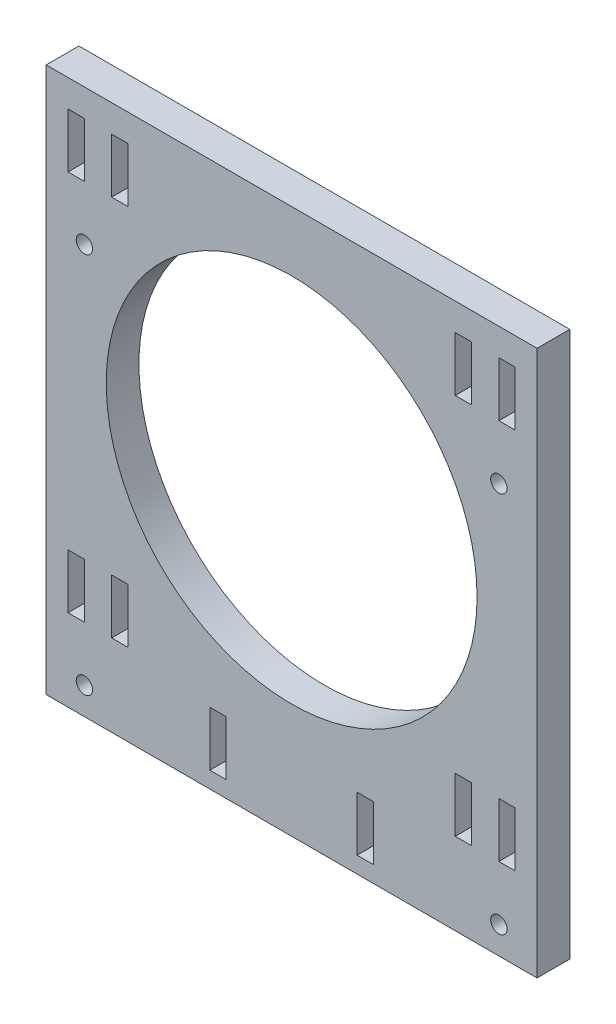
SolidWorks part; units mm, degrees
ref_plane "前视基准面" through (0, 0, 0) normal (0, 0, 1) x (1, 0, 0)
ref_plane "上视基准面" through (0, 0, 0) normal (0, 1, 0) x (1, 0, 0)
ref_plane "右视基准面" through (0, 0, 0) normal (1, 0, 0) x (0, 0, -1)
sketch "草图1" plane through (0, 0, 0) normal (0, 0, 1) x (1, 0, 0)
  line L0 (0, 0) -> (-23.7764, 7.7254) construction
  circle A0 centre (0, 0) radius 12.5
  circle A1 centre (0, 25) radius 12.5
  circle A2 centre (23.7764, 7.7254) radius 12.5
  circle A3 centre (14.6946, -20.2254) radius 12.5
  circle A4 centre (-14.6946, -20.2254) radius 12.5
  circle A5 centre (-23.7764, 7.7254) radius 12.5
  circle A6 centre (-23.7764, 7.7254) radius 10.5
  circle A7 centre (0, 25) radius 10.5
  circle A8 centre (23.7764, 7.7254) radius 10.5
  circle A9 centre (-14.6946, -20.2254) radius 10.5
  circle A10 centre (14.6946, -20.2254) radius 10.5
  circle A11 centre (-23.7764, 7.7254) radius 9
  circle A12 centre (0, 25) radius 9
  circle A13 centre (23.7764, 7.7254) radius 9
  circle A14 centre (14.6946, -20.2254) radius 9
  circle A15 centre (-14.6946, -20.2254) radius 9
  circle A17 centre (0, 0) radius 35.5
  point P16 (0, 0)
  dimension "D1" = 25
  dimension "D2" = 25
  dimension "D4" = 21
  dimension "D5" = 21
  dimension "D6" = 21
  dimension "D7" = 21
  dimension "D8" = 18
  dimension "D11" = 21
  dimension "D3" = 5
  dimension "D10" = 25
  dimension "D9" = 5
sketch "草图2" plane through (0, 0, 0) normal (0, 0, 1) x (1, 0, 0)
  line L0 (-10.5, 25) -> (-10.5, 27.9643)
  line L1 (10.5, 25) -> (10.5, 27.9643)
  line L2 (20.5317, 17.7115) -> (23.3509, 18.6275)
  line L3 (27.0211, -2.2607) -> (29.8403, -1.3447)
  line L4 (23.1893, -14.0537) -> (24.9317, -16.4518)
  line L5 (6.2, -26.3972) -> (7.9423, -28.7953)
  line L6 (-6.2, -26.3972) -> (-7.9423, -28.7953)
  line L7 (-23.1893, -14.0537) -> (-24.9317, -16.4518)
  line L8 (-27.0211, -2.2607) -> (-29.8403, -1.3447)
  line L9 (-20.5317, 17.7115) -> (-23.3509, 18.6275)
  line L11 (0, 0) -> (27.0211, -2.2607) construction
  circle A0 centre (14.6946, -20.2254) radius 10.5 construction
  circle A1 centre (-14.6946, -20.2254) radius 10.5 construction
  circle A2 centre (23.7764, 7.7254) radius 10.5 construction
  circle A3 centre (0, 25) radius 10.5 construction
  circle A4 centre (-23.7764, 7.7254) radius 10.5 construction
  circle A5 centre (0, 0) radius 35.5 construction
  arc A6 (23.1893, -14.0537) -> (6.2, -26.3972) centre (14.6946, -20.2254) ccw
  arc A7 (-6.2, -26.3972) -> (-23.1893, -14.0537) centre (-14.6946, -20.2254) ccw
  arc A8 (20.5317, 17.7115) -> (27.0211, -2.2607) centre (23.7764, 7.7254) ccw
  arc A9 (-10.5, 25) -> (10.5, 25) centre (0, 25) ccw
  arc A10 (-27.0211, -2.2607) -> (-20.5317, 17.7115) centre (-23.7764, 7.7254) ccw
  arc A11 (-16.3413, 31.5153) -> (-24.9231, 25.2802) centre (0, 0) ccw
  arc A12 (-35.0225, -5.8027) -> (-31.7446, -15.8912) centre (0, 0) ccw
  arc A13 (24.9231, 25.2802) -> (16.3413, 31.5153) centre (0, 0) ccw
  arc A14 (31.7446, -15.8912) -> (35.0225, -5.8027) centre (0, 0) ccw
  arc A15 (-5.3039, -35.1016) -> (5.3039, -35.1016) centre (0, 0) ccw
  arc A16 (23.3509, 18.6275) -> (24.9231, 25.2802) centre (22.1148, 22.4318) ccw
  arc A17 (10.5, 27.9643) -> (16.3413, 31.5153) centre (14.5, 27.9643) cw
  arc A18 (-10.5, 27.9643) -> (-16.3413, 31.5153) centre (-14.5, 27.9643) ccw
  arc A19 (-23.3509, 18.6275) -> (-24.9231, 25.2802) centre (-22.1148, 22.4318) cw
  arc A20 (24.9317, -16.4518) -> (31.7446, -15.8912) centre (28.1677, -14.1007) ccw
  arc A21 (7.9423, -28.7953) -> (5.3039, -35.1016) centre (4.7062, -31.1465) cw
  arc A22 (-7.9423, -28.7953) -> (-5.3039, -35.1016) centre (-4.7062, -31.1465) ccw
  arc A23 (-24.9317, -16.4518) -> (-31.7446, -15.8912) centre (-28.1677, -14.1007) cw
  arc A24 (-35.0225, -5.8027) -> (-29.8403, -1.3447) centre (-31.0763, -5.1489) cw
  arc A25 (29.8403, -1.3447) -> (35.0225, -5.8027) centre (31.0763, -5.1489) cw
  dimension "D2" = 4
  dimension "D3" = 4
  dimension "D1" = 5
sketch "草图3" plane through (0, 0, 0) normal (0, 0, 1) x (1, 0, 0)
  line L0 (-45, 45) -> (45, 45)
  line L1 (45, 45) -> (45, -45)
  line L3 (-45, -45) -> (-45, 45)
  line L4 (-45, -45) -> (-45, -55)
  line L7 (-45, -55) -> (45, -55)
  line L8 (45, -45) -> (45, -55)
  circle A16 centre (0, 0) radius 34
  dimension "D4" = 68
  dimension "D1" = 90
  dimension "D2" = 90
  dimension "D3" = 10
extrude "凸台-拉伸2" add sketch "草图3" along normal blind 6
sketch "草图4" plane through (0, 0, 6) normal (0, 0, 1) x (1, 0, 0)
  circle A0 centre (0, 0) radius 13.5
sketch "草图5" plane through (0, 0, 6) normal (0, 0, 1) x (1, 0, 0)
  line L0 (-33, 40) -> (-33, 30)
  line L1 (-33, 30) -> (-30, 30)
  line L2 (-30, 30) -> (-30, 40)
  line L3 (-30, 40) -> (-33, 40)
  line L4 (30, 40) -> (30, 30)
  line L5 (30, 30) -> (33, 30)
  line L6 (33, 30) -> (33, 40)
  line L7 (33, 40) -> (30, 40)
  line L8 (-33, -30) -> (-33, -40)
  line L9 (-33, -40) -> (-30, -40)
  line L10 (-30, -40) -> (-30, -30)
  line L11 (-30, -30) -> (-33, -30)
  line L12 (30, -30) -> (30, -40)
  line L13 (30, -40) -> (33, -40)
  line L14 (33, -40) -> (33, -30)
  line L15 (33, -30) -> (30, -30)
  line L16 (0, 45) -> (0, -54.353) construction
  line L17 (-45, 45) -> (45, 45) construction
  line L18 (-45, 0) -> (45, 0) construction
  line L19 (-45, -55) -> (-45, 45) construction
  line L20 (45, -55) -> (45, 45) construction
  dimension "D1" = 3
  dimension "D2" = 10
  dimension "D3" = 10
  dimension "D4" = 3
  dimension "D5" = 10
  dimension "D6" = 3
  dimension "D7" = 3
  dimension "D8" = 10
  dimension "D9" = 30
  dimension "D10" = 30
  dimension "D11" = 30
  dimension "D12" = 30
  dimension "D13" = 30
  dimension "D14" = 30
  dimension "D15" = 30
  dimension "D16" = 30
extrude "切除-拉伸2" cut sketch "草图5" against normal through all
sketch "草图6" plane through (0, 0, 6) normal (0, 0, 1) x (1, 0, 0)
  line L0 (-38, -30) -> (-38, -40)
  line L1 (-38, -40) -> (-41, -40)
  line L2 (-41, -40) -> (-41, -30)
  line L3 (-41, -30) -> (-38, -30)
  line L4 (-33, -30) -> (-33, -40) construction
  line L5 (-30, -30) -> (-33, -30) construction
  line L6 (-41, 40) -> (-41, 30)
  line L7 (-41, 30) -> (-38, 30)
  line L8 (-38, 30) -> (-38, 40)
  line L9 (-38, 40) -> (-41, 40)
  line L10 (-30, 40) -> (-33, 40) construction
  line L11 (-45, 45) -> (45, 45) construction
  line L16 (-15, -42) -> (-15, -52)
  line L17 (-15, -52) -> (-12, -52)
  line L18 (-12, -52) -> (-12, -42)
  line L19 (-15, -42) -> (-12, -42)
  line L20 (0, 45) -> (0, -55.2023) construction
  line L21 (15, -42) -> (12, -42)
  line L22 (12, -52) -> (12, -42)
  line L23 (15, -52) -> (12, -52)
  line L24 (15, -42) -> (15, -52)
  line L25 (38, 40) -> (41, 40)
  line L26 (38, 30) -> (38, 40)
  line L27 (41, 30) -> (38, 30)
  line L28 (41, 40) -> (41, 30)
  line L29 (41, -30) -> (38, -30)
  line L30 (41, -40) -> (41, -30)
  line L31 (38, -40) -> (41, -40)
  line L32 (38, -30) -> (38, -40)
  line L33 (-45, -55) -> (45, -55) construction
  circle A0 centre (-38, -50) radius 1.5
  circle A1 centre (-38, 20) radius 1.5
  circle A2 centre (38, 20) radius 1.5
  circle A3 centre (38, -50) radius 1.5
  dimension "D7" = 25
  dimension "D8" = 3
  dimension "D9" = 3
  dimension "D10" = 5
  dimension "D1" = 5
  dimension "D2" = 3
  dimension "D3" = 10
  dimension "D4" = 10
  dimension "D5" = 0
  dimension "D6" = 3
  dimension "D11" = 3
  dimension "D12" = 10
  dimension "D13" = 3
  dimension "D14" = 12
extrude "切除-拉伸3" cut sketch "草图6" against normal blind 10
